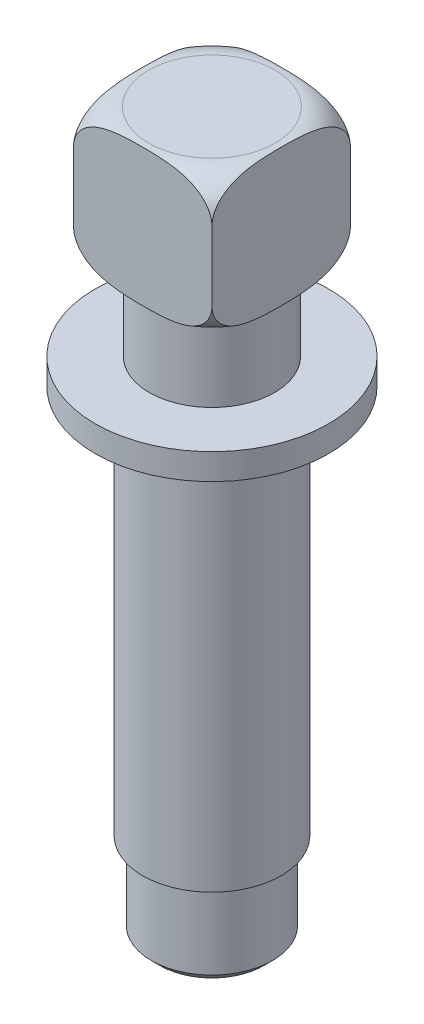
SolidWorks part; units mm, degrees
ref_plane "Front" through (0, 0, 0) normal (0, 0, 1) x (1, 0, 0)
ref_plane "Top" through (0, 0, 0) normal (0, 1, 0) x (1, 0, 0)
ref_plane "Right" through (0, 0, 0) normal (1, 0, 0) x (0, 0, -1)
sketch "Sketch1" plane through (0, 0, 0) normal (0, 1, 0) x (1, 0, 0)
  line L0 (8, -8) -> (-8, 8) construction
  line L1 (-8, 8) -> (8, 8)
  line L2 (-8, 8) -> (-8, -8)
  line L3 (-8, -8) -> (8, -8)
  line L4 (8, 8) -> (8, -8)
  dimension "D1" = 16
extrude "Extrude1" add sketch "Sketch1" along normal blind 16
ref_plane "Plane1" through (0, 0, 0) normal (-0.7071, 0, -0.7071) x (-0.7071, 0, 0.7071)
sketch "Sketch2" plane through (0, 0, 0) normal (-0.7071, 0, -0.7071) x (-0.7071, 0, 0.7071)
  line L2 (0, 16) -> (11.3137, 16) construction
  line L3 (11.3137, 16) -> (11.3137, 0) construction
  line L4 (7.3137, 16) -> (7.3137, 17.606)
  line L5 (7.3137, 17.606) -> (12.4503, 17.606)
  line L6 (12.4503, 17.606) -> (12.4503, 12)
  line L7 (12.4503, 12) -> (11.3137, 12)
  line L8 (0, 0) -> (0, 18.7218) construction
  line L9 (-11.3137, 8) -> (11.3137, 8) construction
  line L10 (-11.3137, 16) -> (-11.3137, 0) construction
  line L11 (12.4503, 4) -> (11.3137, 4)
  line L12 (12.4503, -1.606) -> (12.4503, 4)
  line L13 (7.3137, -1.606) -> (12.4503, -1.606)
  line L14 (7.3137, 0) -> (7.3137, -1.606)
  arc A0 (11.3137, 12) -> (7.3137, 16) centre (7.3137, 12) ccw
  arc A1 (11.3137, 4) -> (7.3137, 0) centre (7.3137, 4) cw
  dimension "D1" = 4
revolve "Cut-Revolve1" cut sketch "Sketch2" angle 360 about L8
sketch "Sketch3" plane through (0, 0, 0) normal (0, 0, 1) x (1, 0, 0)
  line L0 (0, 0) -> (0, -68.2543) construction
  line L1 (0, 0) -> (7.25, 0)
  line L2 (-7.3137, 0) -> (7.3137, 0) construction
  line L3 (7.25, 0) -> (7.25, -9)
  line L4 (7.25, -9) -> (13.5, -9)
  line L5 (13.5, -9) -> (13.5, -12)
  line L6 (13.5, -12) -> (8, -12)
  line L7 (8, -12) -> (8, -57)
  line L8 (8, -57) -> (7, -57)
  line L9 (0, -67) -> (0, 0)
  line L10 (7.3137, 16) -> (-7.3137, 16) construction
  line L11 (7, -57) -> (7, -67)
  line L12 (7, -67) -> (0, -67)
  dimension "D1" = 14.5
  dimension "D2" = 27
  dimension "D3" = 16
  dimension "D4" = 45
  dimension "D5" = 3
  dimension "D6" = 25
  dimension "D7" = 14
  dimension "D8" = 10
revolve "Revolve1" add sketch "Sketch3" angle 360 about L0
chamfer "Chamfer1" distance 1 angle 45
